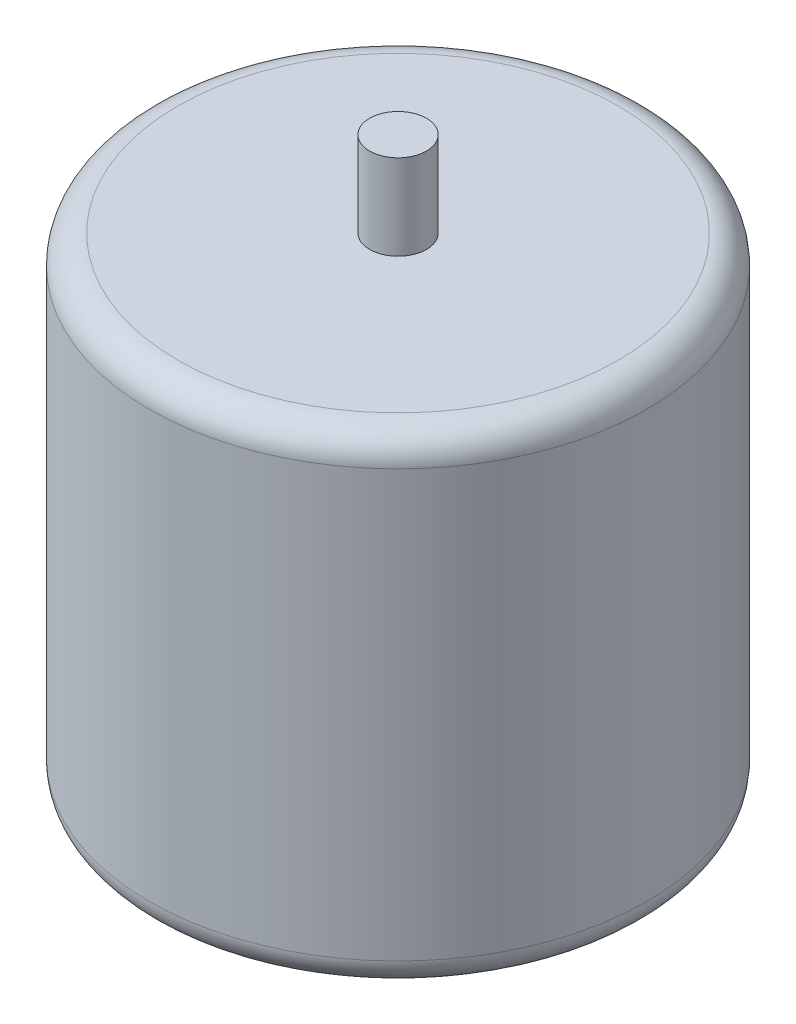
SolidWorks part; units mm, degrees
ref_plane "前视基准面" through (0, 0, 0) normal (0, 0, 1) x (1, 0, 0)
ref_plane "上视基准面" through (0, 0, 0) normal (0, 1, 0) x (1, 0, 0)
ref_plane "右视基准面" through (0, 0, 0) normal (1, 0, 0) x (0, 0, -1)
sketch "草图1" plane through (0, 0, 0) normal (0, 1, 0) x (1, 0, 0)
  circle A0 centre (0, 0) radius 17.5
  dimension "D1" = 35
extrude "凸台-拉伸1" add sketch "草图1" along normal blind 34
fillet "圆角1" radius 2 2 edges at (0, 0, 17.5) (0, 34, 17.5)
sketch "草图2" plane through (0, 34, 0) normal (0, 1, 0) x (1, 0, 0)
  circle A0 centre (0, 0) radius 2
  dimension "D1" = 4
extrude "凸台-拉伸2" add sketch "草图2" along normal blind 6
